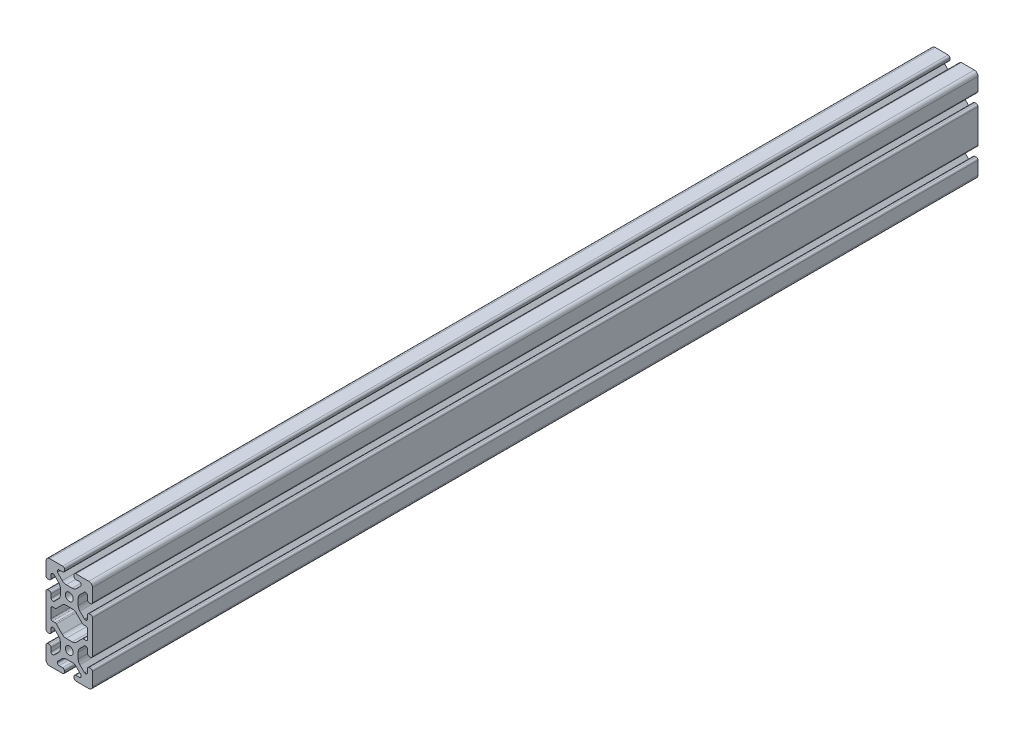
SolidWorks part; units mm, degrees
ref_plane "Front Plane" through (0, 0, 0) normal (0, 0, 1) x (1, 0, 0)
ref_plane "Top Plane" through (0, 0, 0) normal (0, 1, 0) x (1, 0, 0)
ref_plane "Right Plane" through (0, 0, 0) normal (1, 0, 0) x (0, 0, -1)
ref_plane "Plane1" through (0, 0, -3048) normal (0, 0, -1) x (-1, 0, 0)
sketch "Sketch1" plane through (0, 0, -3048) normal (0, 0, -1) x (-1, 0, 0)
  line L0 (14.41, 14.6586) -> (12.13, 14.6586)
  line L1 (11.1794, 14.2308) -> (6.0551, 9.1098)
  line L2 (2.6153, 7.685) -> (-2.6153, 7.685)
  line L3 (-6.0551, 9.1098) -> (-11.232, 14.2867)
  line L4 (-12.13, 14.6586) -> (-14.41, 14.6586)
  line L5 (-15.68, 15.9286) -> (-15.68, 24.0714)
  line L6 (-14.41, 25.3414) -> (-12.13, 25.3414)
  line L7 (-11.232, 25.7133) -> (-6.0551, 30.8902)
  line L8 (-2.6153, 32.315) -> (2.6176, 32.315)
  line L9 (6.0573, 30.8902) -> (11.1842, 25.7634)
  line L10 (12.13, 25.3414) -> (14.41, 25.3414)
  line L11 (15.68, 24.0714) -> (15.68, 15.9286)
  line L12 (16.83, 60) -> (5.6904, 60)
  line L13 (4.1204, 58.43) -> (4.1204, 57.25)
  line L14 (5.6904, 55.68) -> (8.7154, 55.68)
  line L15 (10.2854, 54.11) -> (10.2854, 53.6549)
  line L16 (10.0628, 53.1175) -> (6.0551, 49.1098)
  line L17 (2.6153, 47.685) -> (-2.6153, 47.685)
  line L18 (-6.0551, 49.1098) -> (-10.0628, 53.1175)
  line L19 (-10.2854, 53.6549) -> (-10.2854, 54.11)
  line L20 (-8.7154, 55.68) -> (-5.6904, 55.68)
  line L21 (-4.1204, 57.25) -> (-4.1204, 58.43)
  line L22 (-5.6904, 60) -> (-16.83, 60)
  line L23 (-20, 56.83) -> (-20, 45.6904)
  line L24 (-18.43, 44.1204) -> (-17.25, 44.1204)
  line L25 (-15.68, 45.6904) -> (-15.68, 48.7154)
  line L26 (-14.11, 50.2854) -> (-13.6527, 50.2854)
  line L27 (-13.1153, 50.0628) -> (-9.1098, 46.0573)
  line L28 (-7.685, 42.6176) -> (-7.685, 37.3847)
  line L29 (-9.1098, 33.9449) -> (-13.1175, 29.9372)
  line L30 (-13.6549, 29.7146) -> (-14.11, 29.7146)
  line L31 (-15.68, 31.2846) -> (-15.68, 34.3096)
  line L32 (-17.25, 35.8796) -> (-18.43, 35.8796)
  line L33 (-20, 34.3096) -> (-20, 5.6904)
  line L34 (-18.43, 4.1204) -> (-17.25, 4.1204)
  line L35 (-15.68, 5.6904) -> (-15.68, 8.7154)
  line L36 (-14.11, 10.2854) -> (-13.6549, 10.2854)
  line L37 (-13.1175, 10.0628) -> (-9.1098, 6.0551)
  line L38 (-7.685, 2.6153) -> (-7.685, -2.6153)
  line L39 (-9.1098, -6.0551) -> (-13.1175, -10.0628)
  line L40 (-13.6549, -10.2854) -> (-14.11, -10.2854)
  line L41 (-15.68, -8.7154) -> (-15.68, -5.6904)
  line L42 (-17.25, -4.1204) -> (-18.43, -4.1204)
  line L43 (-20, -5.6904) -> (-20, -16.83)
  line L44 (-16.83, -20) -> (-5.6904, -20)
  line L45 (-4.1204, -18.43) -> (-4.1204, -17.25)
  line L46 (-5.6904, -15.68) -> (-8.7154, -15.68)
  line L47 (-10.2854, -14.11) -> (-10.2854, -13.6549)
  line L48 (-10.0628, -13.1175) -> (-6.0551, -9.1098)
  line L49 (-2.6153, -7.685) -> (2.6153, -7.685)
  line L50 (6.0551, -9.1098) -> (10.0628, -13.1175)
  line L51 (10.2854, -13.6549) -> (10.2854, -14.11)
  line L52 (8.7154, -15.68) -> (5.6904, -15.68)
  line L53 (4.1204, -17.25) -> (4.1204, -18.43)
  line L54 (5.6904, -20) -> (16.83, -20)
  line L55 (20, -16.83) -> (20, -5.6904)
  line L56 (18.43, -4.1204) -> (17.25, -4.1204)
  line L57 (15.68, -5.6904) -> (15.68, -8.7154)
  line L58 (14.11, -10.2854) -> (13.6549, -10.2854)
  line L59 (13.1175, -10.0628) -> (9.1098, -6.0551)
  line L60 (7.685, -2.6153) -> (7.685, 2.6153)
  line L61 (9.1098, 6.0551) -> (13.1175, 10.0628)
  line L62 (13.6549, 10.2854) -> (14.11, 10.2854)
  line L63 (15.68, 8.7154) -> (15.68, 5.6904)
  line L64 (17.25, 4.1204) -> (18.43, 4.1204)
  line L65 (20, 5.6904) -> (20, 34.3096)
  line L66 (18.43, 35.8796) -> (17.25, 35.8796)
  line L67 (15.68, 34.3096) -> (15.68, 31.2846)
  line L68 (14.11, 29.7146) -> (13.6549, 29.7146)
  line L69 (13.1175, 29.9372) -> (9.1098, 33.9449)
  line L70 (7.685, 37.3847) -> (7.685, 42.6153)
  line L71 (9.1098, 46.0551) -> (13.1175, 50.0628)
  line L72 (13.6549, 50.2854) -> (14.11, 50.2854)
  line L73 (15.68, 48.7154) -> (15.68, 45.6904)
  line L74 (17.25, 44.1204) -> (18.43, 44.1204)
  line L75 (20, 45.6904) -> (20, 56.83)
  arc A0 (15.68, 15.9286) -> (14.41, 14.6586) centre (14.41, 15.9286) cw
  arc A1 (12.13, 14.6586) -> (11.1794, 14.2308) centre (12.13, 13.3886) ccw
  arc A2 (6.0551, 9.1098) -> (2.6153, 7.685) centre (2.6153, 12.5496) cw
  arc A3 (-2.6153, 7.685) -> (-6.0551, 9.1098) centre (-2.6153, 12.5496) cw
  arc A4 (-11.232, 14.2867) -> (-12.13, 14.6586) centre (-12.13, 13.3886) ccw
  arc A5 (-14.41, 14.6586) -> (-15.68, 15.9286) centre (-14.41, 15.9286) cw
  arc A6 (-15.68, 24.0714) -> (-14.41, 25.3414) centre (-14.41, 24.0714) cw
  arc A7 (-12.13, 25.3414) -> (-11.232, 25.7133) centre (-12.13, 26.6114) ccw
  arc A8 (-6.0551, 30.8902) -> (-2.6153, 32.315) centre (-2.6153, 27.4504) cw
  arc A9 (2.6176, 32.315) -> (6.0573, 30.8902) centre (2.6176, 27.4504) cw
  arc A10 (11.1842, 25.7634) -> (12.13, 25.3414) centre (12.13, 26.6123) ccw
  arc A11 (14.41, 25.3414) -> (15.68, 24.0714) centre (14.41, 24.0714) cw
  circle A12 centre (0, 0) radius 3.405
  circle A13 centre (0, 40) radius 3.405
  arc A14 (5.6904, 60) -> (4.1204, 58.43) centre (5.6904, 58.43) ccw
  arc A15 (4.1204, 57.25) -> (5.6904, 55.68) centre (5.6904, 57.25) ccw
  arc A16 (8.7154, 55.68) -> (10.2854, 54.11) centre (8.7154, 54.11) cw
  arc A17 (10.2854, 53.6549) -> (10.0628, 53.1175) centre (9.5254, 53.6549) cw
  arc A18 (6.0551, 49.1098) -> (2.6153, 47.685) centre (2.6153, 52.5496) cw
  arc A19 (-2.6153, 47.685) -> (-6.0551, 49.1098) centre (-2.6153, 52.5496) cw
  arc A20 (-10.0628, 53.1175) -> (-10.2854, 53.6549) centre (-9.5254, 53.6549) cw
  arc A21 (-10.2854, 54.11) -> (-8.7154, 55.68) centre (-8.7154, 54.11) cw
  arc A22 (-5.6904, 55.68) -> (-4.1204, 57.25) centre (-5.6904, 57.25) ccw
  arc A23 (-4.1204, 58.43) -> (-5.6904, 60) centre (-5.6904, 58.43) ccw
  arc A24 (-16.83, 60) -> (-20, 56.83) centre (-16.83, 56.83) ccw
  arc A25 (-20, 45.6904) -> (-18.43, 44.1204) centre (-18.43, 45.6904) ccw
  arc A26 (-17.25, 44.1204) -> (-15.68, 45.6904) centre (-17.25, 45.6904) ccw
  arc A27 (-15.68, 48.7154) -> (-14.11, 50.2854) centre (-14.11, 48.7154) cw
  arc A28 (-13.6527, 50.2854) -> (-13.1153, 50.0628) centre (-13.6527, 49.5254) cw
  arc A29 (-9.1098, 46.0573) -> (-7.685, 42.6176) centre (-12.5496, 42.6176) cw
  arc A30 (-7.685, 37.3847) -> (-9.1098, 33.9449) centre (-12.5496, 37.3847) cw
  arc A31 (-13.1175, 29.9372) -> (-13.6549, 29.7146) centre (-13.6549, 30.4746) cw
  arc A32 (-14.11, 29.7146) -> (-15.68, 31.2846) centre (-14.11, 31.2846) cw
  arc A33 (-15.68, 34.3096) -> (-17.25, 35.8796) centre (-17.25, 34.3096) ccw
  arc A34 (-18.43, 35.8796) -> (-20, 34.3096) centre (-18.43, 34.3096) ccw
  arc A35 (-20, 5.6904) -> (-18.43, 4.1204) centre (-18.43, 5.6904) ccw
  arc A36 (-17.25, 4.1204) -> (-15.68, 5.6904) centre (-17.25, 5.6904) ccw
  arc A37 (-15.68, 8.7154) -> (-14.11, 10.2854) centre (-14.11, 8.7154) cw
  arc A38 (-13.6549, 10.2854) -> (-13.1175, 10.0628) centre (-13.6549, 9.5254) cw
  arc A39 (-9.1098, 6.0551) -> (-7.685, 2.6153) centre (-12.5496, 2.6153) cw
  arc A40 (-7.685, -2.6153) -> (-9.1098, -6.0551) centre (-12.5496, -2.6153) cw
  arc A41 (-13.1175, -10.0628) -> (-13.6549, -10.2854) centre (-13.6549, -9.5254) cw
  arc A42 (-14.11, -10.2854) -> (-15.68, -8.7154) centre (-14.11, -8.7154) cw
  arc A43 (-15.68, -5.6904) -> (-17.25, -4.1204) centre (-17.25, -5.6904) ccw
  arc A44 (-18.43, -4.1204) -> (-20, -5.6904) centre (-18.43, -5.6904) ccw
  arc A45 (-20, -16.83) -> (-16.83, -20) centre (-16.83, -16.83) ccw
  arc A46 (-5.6904, -20) -> (-4.1204, -18.43) centre (-5.6904, -18.43) ccw
  arc A47 (-4.1204, -17.25) -> (-5.6904, -15.68) centre (-5.6904, -17.25) ccw
  arc A48 (-8.7154, -15.68) -> (-10.2854, -14.11) centre (-8.7154, -14.11) cw
  arc A49 (-10.2854, -13.6549) -> (-10.0628, -13.1175) centre (-9.5254, -13.6549) cw
  arc A50 (-6.0551, -9.1098) -> (-2.6153, -7.685) centre (-2.6153, -12.5496) cw
  arc A51 (2.6153, -7.685) -> (6.0551, -9.1098) centre (2.6153, -12.5496) cw
  arc A52 (10.0628, -13.1175) -> (10.2854, -13.6549) centre (9.5254, -13.6549) cw
  arc A53 (10.2854, -14.11) -> (8.7154, -15.68) centre (8.7154, -14.11) cw
  arc A54 (5.6904, -15.68) -> (4.1204, -17.25) centre (5.6904, -17.25) ccw
  arc A55 (4.1204, -18.43) -> (5.6904, -20) centre (5.6904, -18.43) ccw
  arc A56 (16.83, -20) -> (20, -16.83) centre (16.83, -16.83) ccw
  arc A57 (20, -5.6904) -> (18.43, -4.1204) centre (18.43, -5.6904) ccw
  arc A58 (17.25, -4.1204) -> (15.68, -5.6904) centre (17.25, -5.6904) ccw
  arc A59 (15.68, -8.7154) -> (14.11, -10.2854) centre (14.11, -8.7154) cw
  arc A60 (13.6549, -10.2854) -> (13.1175, -10.0628) centre (13.6549, -9.5254) cw
  arc A61 (9.1098, -6.0551) -> (7.685, -2.6153) centre (12.5496, -2.6153) cw
  arc A62 (7.685, 2.6153) -> (9.1098, 6.0551) centre (12.5496, 2.6153) cw
  arc A63 (13.1175, 10.0628) -> (13.6549, 10.2854) centre (13.6549, 9.5254) cw
  arc A64 (14.11, 10.2854) -> (15.68, 8.7154) centre (14.11, 8.7154) cw
  arc A65 (15.68, 5.6904) -> (17.25, 4.1204) centre (17.25, 5.6904) ccw
  arc A66 (18.43, 4.1204) -> (20, 5.6904) centre (18.43, 5.6904) ccw
  arc A67 (20, 34.3096) -> (18.43, 35.8796) centre (18.43, 34.3096) ccw
  arc A68 (17.25, 35.8796) -> (15.68, 34.3096) centre (17.25, 34.3096) ccw
  arc A69 (15.68, 31.2846) -> (14.11, 29.7146) centre (14.11, 31.2846) cw
  arc A70 (13.6549, 29.7146) -> (13.1175, 29.9372) centre (13.6549, 30.4746) cw
  arc A71 (9.1098, 33.9449) -> (7.685, 37.3847) centre (12.5496, 37.3847) cw
  arc A72 (7.685, 42.6153) -> (9.1098, 46.0551) centre (12.5496, 42.6153) cw
  arc A73 (13.1175, 50.0628) -> (13.6549, 50.2854) centre (13.6549, 49.5254) cw
  arc A74 (14.11, 50.2854) -> (15.68, 48.7154) centre (14.11, 48.7154) cw
  arc A75 (15.68, 45.6904) -> (17.25, 44.1204) centre (17.25, 45.6904) ccw
  arc A76 (18.43, 44.1204) -> (20, 45.6904) centre (18.43, 45.6904) ccw
  arc A77 (20, 56.83) -> (16.83, 60) centre (16.83, 56.83) ccw
extrude "Boss-Extrude1" add sketch "Sketch1" against normal blind 3048
ref_plane "2.5 ft cut1" through (0, 0, -762) normal (0, 0, 1) x (1, 0, 0)
ref_plane "2.5 ft cut2" through (0, 0, -1524) normal (0, 0, 1) x (1, 0, 0)
ref_plane "16.14 in cut3" through (0, 0, -1933.956) normal (0, 0, 1) x (1, 0, 0)
ref_plane "13 in cut4" through (0, 0, -2264.156) normal (0, 0, 1) x (1, 0, 0)
ref_plane "midplane cut5" through (0, 0, -2656.078) normal (0, 0, 1) x (1, 0, 0)
sketch "Sketch26" plane through (0, 0, -762) normal (0, 0, 1) x (1, 0, 0)
  line L0 (-20, -20.8001) -> (20, -20.8001)
  line L1 (-20, -20.8001) -> (-20, 60)
  line L2 (-20, 60) -> (20, 60)
  line L3 (20, -20.8001) -> (20, 60)
sketch "Sketch33" plane through (0, 0, -1524) normal (0, 0, 1) x (1, 0, 0)
  line L0 (-20, -20.8001) -> (20, -20.8001)
  line L1 (-20, -20.8001) -> (-20, 60)
  line L2 (-20, 60) -> (20, 60)
  line L3 (20, -20.8001) -> (20, 60)
  line L5 (-20, 60) -> (20, 60)
  line L6 (-20, 60) -> (-20, -20.8001)
  line L7 (-20, -20.8001) -> (20, -20.8001)
  line L8 (20, 60) -> (20, -20.8001)
sketch "Sketch41" plane through (0, 0, -1933.956) normal (0, 0, 1) x (1, 0, 0)
  line L0 (-20, -20.8001) -> (20, -20.8001)
  line L1 (-20, -20.8001) -> (-20, 60)
  line L2 (-20, 60) -> (20, 60)
  line L3 (20, -20.8001) -> (20, 60)
sketch "Sketch50" plane through (0, 0, -2264.156) normal (0, 0, 1) x (1, 0, 0)
  line L0 (-20, -20.8001) -> (20, -20.8001)
  line L1 (-20, -20.8001) -> (-20, 60)
  line L2 (-20, 60) -> (20, 60)
  line L3 (20, -20.8001) -> (20, 60)
sketch "Sketch51" plane through (0, 0, -2656.078) normal (0, 0, 1) x (1, 0, 0)
  line L1 (-20, 60) -> (20, 60)
  line L2 (-20, 60) -> (-20, -20.8001)
  line L3 (-20, -20.8001) -> (20, -20.8001)
  line L4 (20, 60) -> (20, -20.8001)
extrude "Cut-Extrude1" cut sketch "Sketch26" against normal through all
